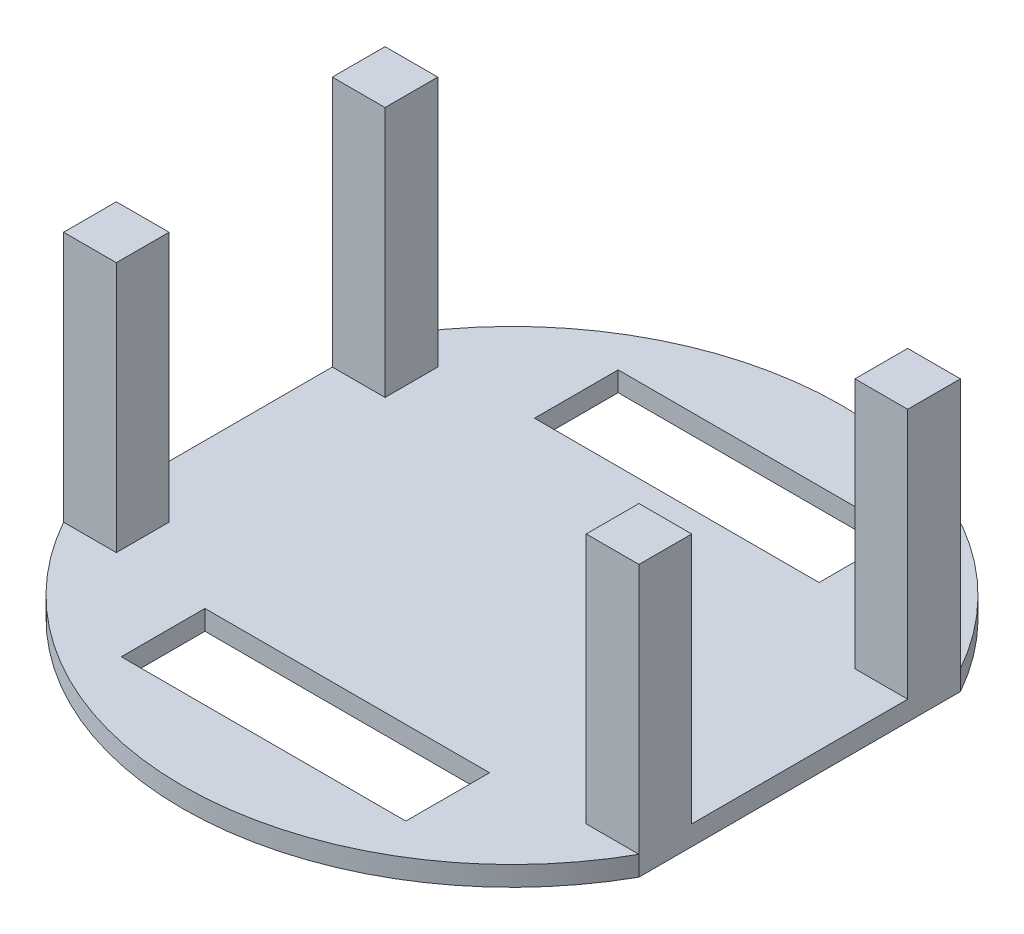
SolidWorks part; units mm, degrees
ref_plane "Front Plane" through (0, 0, 0) normal (0, 0, 1) x (1, 0, 0)
ref_plane "Top Plane" through (0, 0, 0) normal (0, 1, 0) x (1, 0, 0)
ref_plane "Right Plane" through (0, 0, 0) normal (1, 0, 0) x (0, 0, -1)
sketch "Sketch1" plane through (0, 0, 0) normal (0, 1, 0) x (1, 0, 0)
  circle A0 centre (0, 0) radius 50
  dimension "D1" = 100
extrude "Boss-Extrude1" add sketch "Sketch1" along normal blind 3
sketch "Sketch2" plane through (0, 3, 0) normal (0, 1, 0) x (1, 0, 0)
  line L0 (0, 0) -> (-50, 0) construction
  line L1 (0, 0) -> (-43.65, 0) construction
  line L2 (0, 0) -> (43.65, 0) construction
  line L3 (43.65, 0) -> (43.65, 57.9875)
  line L4 (43.65, 57.9875) -> (61.2726, 57.9875)
  line L5 (61.2726, 57.9875) -> (61.2726, -41.6853)
  line L6 (61.2726, -41.6853) -> (43.65, -41.6853)
  line L7 (43.65, -41.6853) -> (43.65, 0)
  line L8 (-43.65, 0) -> (-43.65, 57.9875)
  line L9 (-43.65, 57.9875) -> (-62.1723, 57.9875)
  line L10 (-62.1723, 57.9875) -> (-61.1511, -41.6853)
  line L11 (-61.1511, -41.6853) -> (-43.65, -41.6853)
  line L12 (-43.65, -41.6853) -> (-43.65, 0)
  circle A1 centre (0, 0) radius 50 construction
  dimension "D1" = 43.65
  dimension "D2" = 43.65
  dimension "D3" = 17.6226
  dimension "D4" = 99.6728
  dimension "D5" = 57.9875
extrude "Cut-Extrude1" cut sketch "Sketch2" against normal up to surface (3 mm away)
sketch "Sketch3" plane through (0, 3, 0) normal (0, 1, 0) x (1, 0, 0)
  line L0 (-43.65, 24.386) -> (43.65, 24.386) construction
  line L1 (35.65, 16.386) -> (43.65, 16.386)
  line L2 (43.65, -24.386) -> (-43.65, -24.386) construction
  line L3 (-43.65, -24.386) -> (-43.65, 24.386) construction
  line L4 (43.65, 24.386) -> (35.65, 24.386)
  line L14 (43.65, -24.386) -> (43.65, -15.5541)
  line L17 (-43.65, -24.386) -> (-35.65, -24.386)
  line L18 (-43.65, -24.386) -> (-43.65, -16.386)
  line L19 (-43.65, -16.386) -> (-35.65, -16.386)
  line L20 (-35.65, -24.386) -> (-35.65, -16.386)
  line L21 (35.65, 24.386) -> (35.65, 16.386)
  line L22 (43.65, 24.386) -> (43.65, -24.386) construction
  line L23 (43.65, 16.386) -> (43.65, 24.386)
  line L25 (-43.65, 24.386) -> (-35.65, 24.386)
  line L26 (-43.65, 24.386) -> (-43.65, 16.386)
  line L27 (-43.65, 16.386) -> (-35.65, 16.386)
  line L28 (-35.65, 24.386) -> (-35.65, 16.386)
  line L29 (43.65, -24.386) -> (35.65, -24.386)
  line L30 (43.65, -24.386) -> (43.65, -16.386)
  line L31 (43.65, -16.386) -> (35.65, -16.386)
  line L32 (35.65, -24.386) -> (35.65, -16.386)
  dimension "D1" = 8
  dimension "D2" = 8
  dimension "D3" = 8
  dimension "D4" = 8
  dimension "D5" = 8
  dimension "D6" = 8
  dimension "D7" = 8
  dimension "D8" = 8
extrude "Boss-Extrude2" add sketch "Sketch3" along normal blind 38.1 contours L28 L25 L27 M19 | L4 L21 L1 M17 | L30 L31 L32 L29 | L19 L20 L17 L18
sketch "Sketch4" plane through (0, 0, 0) normal (0, -1, 0) x (1, 0, 0)
  line L0 (0, 0) -> (0, 50) construction
  line L1 (0, 0) -> (0, -50) construction
  line L2 (-43.65, -24.386) -> (43.65, -24.386) construction
  line L3 (-43.65, 24.386) -> (43.65, 24.386) construction
  line L4 (43.65, -24.386) -> (43.65, 24.386) construction
  line L5 (0, 25) -> (21.59, 25)
  line L6 (21.59, 25) -> (21.59, 37.7)
  line L7 (21.59, 37.7) -> (-21.59, 37.7)
  line L8 (-21.59, 37.7) -> (-21.59, 25)
  line L9 (-21.59, 25) -> (0, 25)
  line L10 (0, -25) -> (21.59, -25)
  line L11 (21.59, -25) -> (21.59, -37.7)
  line L12 (21.59, -37.7) -> (-21.59, -37.7)
  line L13 (-21.59, -37.7) -> (-21.59, -25)
  line L14 (-21.59, -25) -> (0, -25)
  arc A0 (43.65, 24.386) -> (-43.65, 24.386) centre (0, 0) ccw construction
  arc A1 (-43.65, -24.386) -> (43.65, -24.386) centre (0, 0) ccw construction
  dimension "D1" = 12.7
  dimension "D2" = 12.7
  dimension "D3" = 21.59
  dimension "D4" = 21.59
  dimension "D5" = 21.59
  dimension "D6" = 21.59
extrude "Cut-Extrude2" cut sketch "Sketch4" against normal up to surface (3 mm away)
